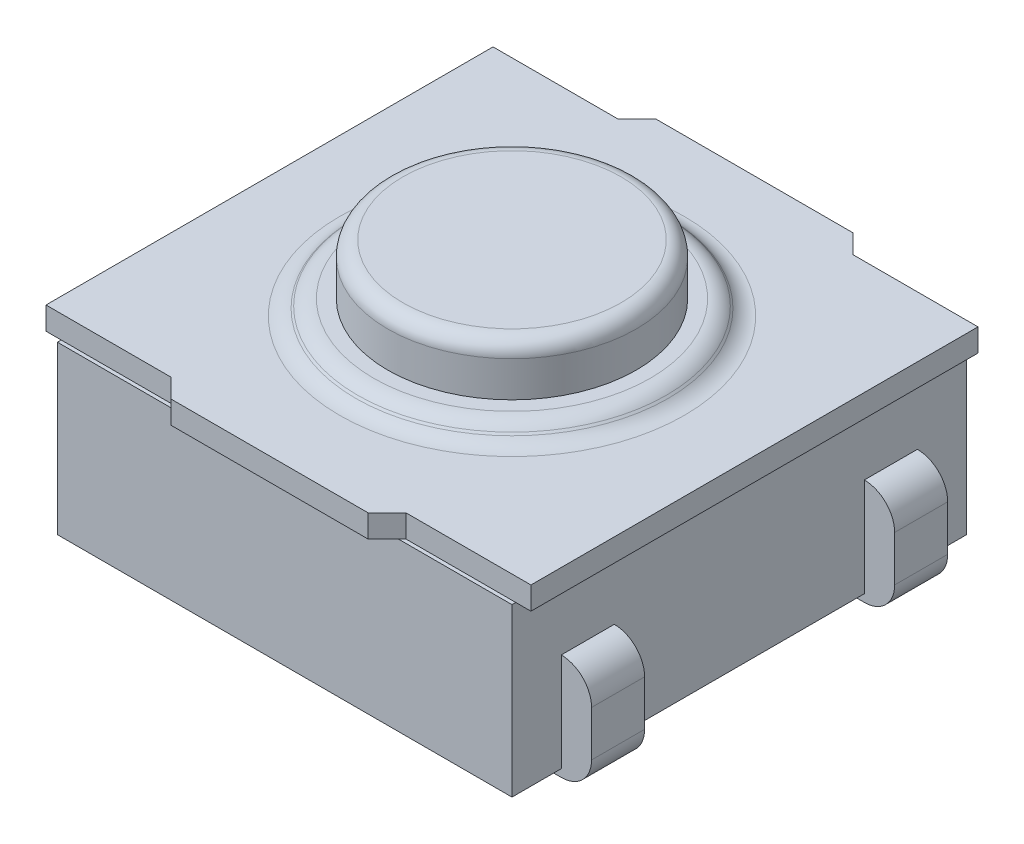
SolidWorks part; units mm, degrees
ref_plane "Front" through (0, 0, 0) normal (0, 0, 1) x (1, 0, 0)
ref_plane "Top" through (0, 0, 0) normal (0, 1, 0) x (1, 0, 0)
ref_plane "Right" through (0, 0, 0) normal (1, 0, 0) x (0, 0, -1)
sketch "Эскиз1" plane through (0, 0, 0) normal (0, 1, 0) x (1, 0, 0)
  line L0 (-3, 0) -> (3, 0) construction
  line L1 (-3, -3) -> (3, -3)
  line L2 (-3, -3) -> (-3, 3)
  line L3 (-3, 3) -> (3, 3)
  line L4 (3, -3) -> (3, 3)
  dimension "D1" = 6
extrude "Вытянуть1" add sketch "Эскиз1" along normal blind 2.2 from offset 0.1
sketch "Эскиз2" plane through (0, 2.3, 0) normal (0, 1, 0) x (-1, 0, 0)
  line L0 (3.2, 2.95) -> (1.55, 2.95)
  line L1 (1.3, -3.2) -> (-1.3, -3.2)
  line L2 (3.2, -2.95) -> (3.2, 2.95)
  line L3 (1.3, 3.2) -> (-1.3, 3.2)
  line L4 (-3.2, -2.95) -> (-3.2, 2.95)
  line L5 (1.55, 2.95) -> (1.3, 3.2)
  line L6 (0, 0) -> (3.2, 0) construction
  line L7 (0, 0) -> (0, 3.2) construction
  line L8 (1.55, -2.95) -> (1.3, -3.2)
  line L9 (3.2, -2.95) -> (1.55, -2.95)
  line L10 (-3.2, -2.95) -> (-1.55, -2.95)
  line L11 (-1.55, -2.95) -> (-1.3, -3.2)
  line L12 (-1.55, 2.95) -> (-1.3, 3.2)
  line L14 (-3.2, 2.95) -> (-1.55, 2.95)
  dimension "D1" = 6.4
  dimension "D2" = 6.4
  dimension "D3" = 5.9
  dimension "D4" = 45
  dimension "D5" = 2.6
extrude "Вытянуть2" add sketch "Эскиз2" along normal blind 0.3
sketch "Эскиз3" plane through (0, 0, 0) normal (0, 0, 1) x (1, 0, 0)
  line L0 (0, 2.6) -> (-2.15, 2.6)
  line L1 (-1.3, 2.6) -> (1.3, 2.6) construction
  line L2 (-3.2, 2.6) -> (-1.55, 2.6) construction
  line L3 (-2.15, 2.6) -> (-1.95, 2.8)
  line L4 (-1.95, 2.8) -> (0, 2.8)
  line L7 (0, 2.8) -> (0, 2.6) construction
  line L8 (0, 2.6) -> (0, 2.8)
  dimension "D3" = 0.2
  dimension "D4" = 45
  dimension "D5" = 4.3
revolve "Повернуть1" add sketch "Эскиз3" angle 360 about L7
sketch "Эскиз5" plane through (0, 0, 0) normal (0, 0, 1) x (1, 0, 0)
  line L0 (0, 2.8) -> (-1.64, 2.8)
  line L1 (1.95, 2.8) -> (-1.95, 2.8) construction
  line L2 (-1.64, 2.8) -> (-1.64, 3.47)
  line L3 (-1.64, 3.47) -> (0, 3.47)
  line L4 (0, 3.47) -> (0, 2.8) construction
  line L5 (0, 2.8) -> (0, 3.47)
  dimension "D1" = 3.28
  dimension "D2" = 3.47
revolve "Повернуть2" add sketch "Эскиз5" angle 360 about L4
sketch "Эскиз4" plane through (0, 0, 0) normal (0, 0, 1) x (1, 0, 0)
  line L0 (-3, 1.4) -> (-3, 0.4)
  line L1 (-3, 0.4) -> (-1.4, 0.4)
  line L2 (-1.8, 0) -> (-3, 0)
  line L3 (-3.4, 0.4) -> (-3.4, 1)
  line L4 (-1.5, 2.3) -> (1.5, 2.3) construction
  line L5 (-3, 2.3) -> (-3, 0.1) construction
  line L6 (-3, 0.1) -> (3, 0.1) construction
  line L7 (0, 0) -> (0, 2.3) construction
  line L9 (3.4, 0.4) -> (3.4, 1)
  line L10 (1.8, 0) -> (3, 0)
  line L11 (3, 0.4) -> (1.4, 0.4)
  line L12 (3, 1.4) -> (3, 0.4)
  arc A0 (-1.4, 0.4) -> (-1.8, 0) centre (-1.8, 0.4) cw
  arc A1 (-3.4, 1) -> (-3, 1.4) centre (-3, 1) cw
  arc A2 (-3, 0) -> (-3.4, 0.4) centre (-3, 0.4) cw
  arc A3 (3, 0) -> (3.4, 0.4) centre (3, 0.4) ccw
  arc A4 (3.4, 1) -> (3, 1.4) centre (3, 1) ccw
  arc A5 (1.4, 0.4) -> (1.8, 0) centre (1.8, 0.4) ccw
  dimension "D1" = 0.4
  dimension "D2" = 1.3
  dimension "D3" = 1.6
extrude "Вытянуть3" add sketch "Эскиз4" along normal mid plane 0.7 from offset 2
mirror "Зеркальное отражение1" about plane through (0, 0, 0) normal (0, 0, 1) of "Вытянуть3"
fillet "Скругление1" radius 0.2 1 edges at (0, 3.47, 1.64)
fillet "Скругление2" radius 0.3 2 edges at (0, 2.6, 2.15) (0, 2.8, 1.95)
